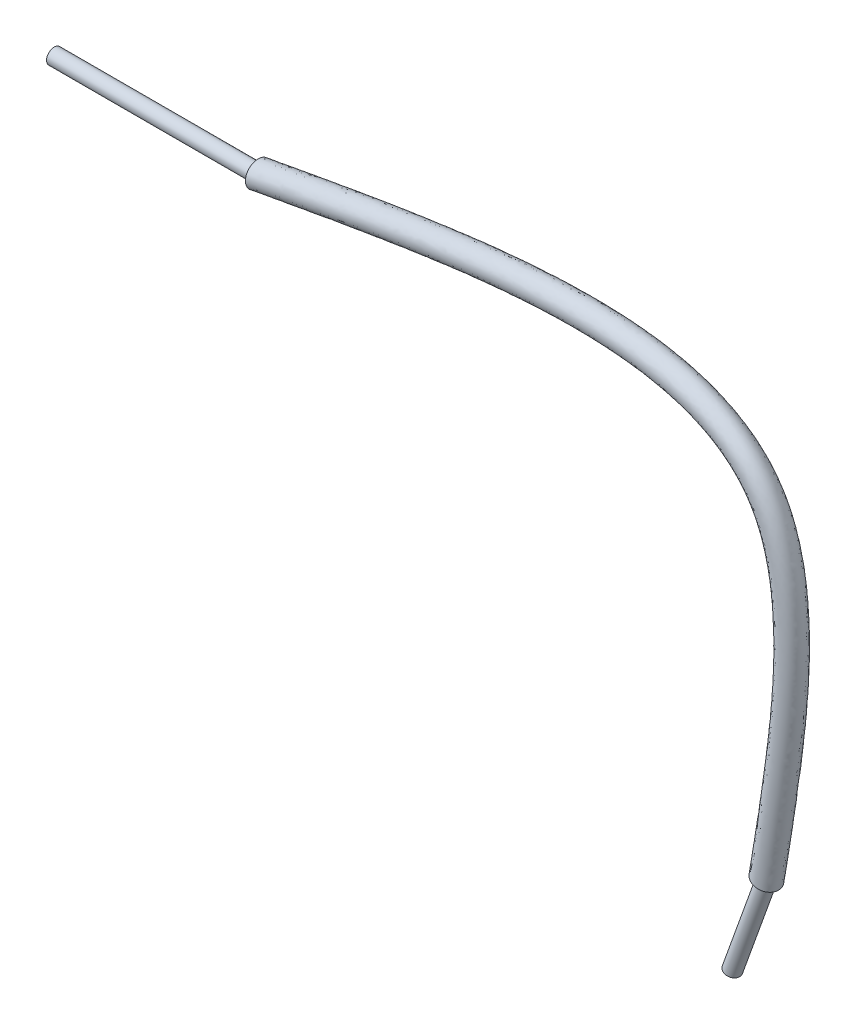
SolidWorks part; units mm, degrees
ref_plane "Plan1" through (0, 0, 0) normal (0, 0, 1) x (1, 0, 0)
ref_plane "Plan2" through (0, 0, 0) normal (0, 1, 0) x (1, 0, 0)
ref_plane "Plan3" through (0, 0, 0) normal (1, 0, 0) x (0, 0, -1)
sketch3d "Esquisse3D1"
  spline_without_curve S0
sketch "Esquisse1" plane through (0, 0, 0) normal (1, 0, 0) x (0, 0, -1)
  circle A0 centre (0, 0) radius 1.25
  dimension "D1" = 2.5
sweep "Base-Balayage" add profiles "Esquisse1" path "Esquisse3D1"
sketch "Esquisse2" plane through (-5.4124, -15.0535, 0) normal (-0.3383, -0.941, 0) x (0.941, -0.3383, 0)
  circle A0 centre (58.7718, 0) radius 0.75
  dimension "D1" = 1.5
extrude "Boss.-Extru.1" add sketch "Esquisse2" along normal blind 10
sketch "Esquisse3" plane through (0, 0, 0) normal (-1, 0, 0) x (0, 0, 1)
  circle A0 centre (0, 0) radius 0.75
  dimension "D1" = 1.5
extrude "Boss.-Extru.2" add sketch "Esquisse3" along normal blind 20
